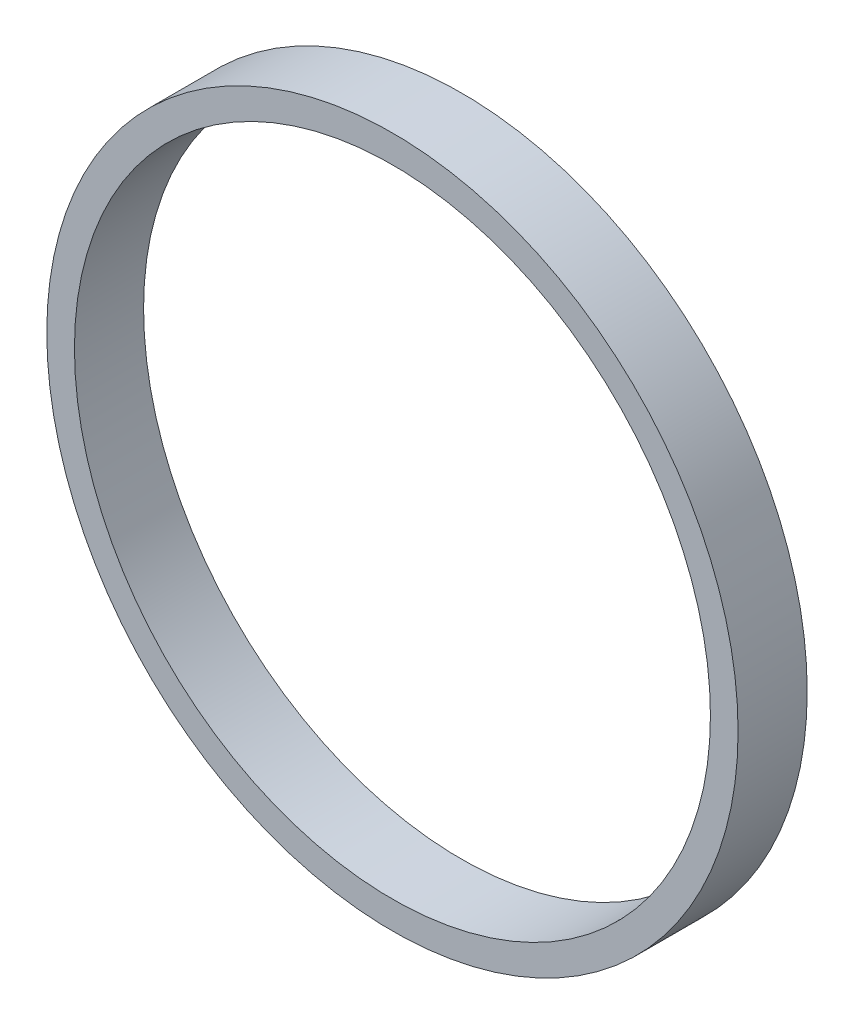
SolidWorks part; units mm, degrees
ref_plane "Front Plane" through (0, 0, 0) normal (0, 0, 1) x (1, 0, 0)
ref_plane "Top Plane" through (0, 0, 0) normal (0, 1, 0) x (1, 0, 0)
ref_plane "Right Plane" through (0, 0, 0) normal (1, 0, 0) x (0, 0, -1)
sketch "Sketch1" plane through (0, 0, 0) normal (0, 0, 1) x (1, 0, 0)
  circle A0 centre (0, 0) radius 25
  circle A1 centre (0, 0) radius 23
  dimension "D1" = 46
  dimension "D2" = 2
extrude "Boss-Extrude1" add sketch "Sketch1" along normal blind 5
